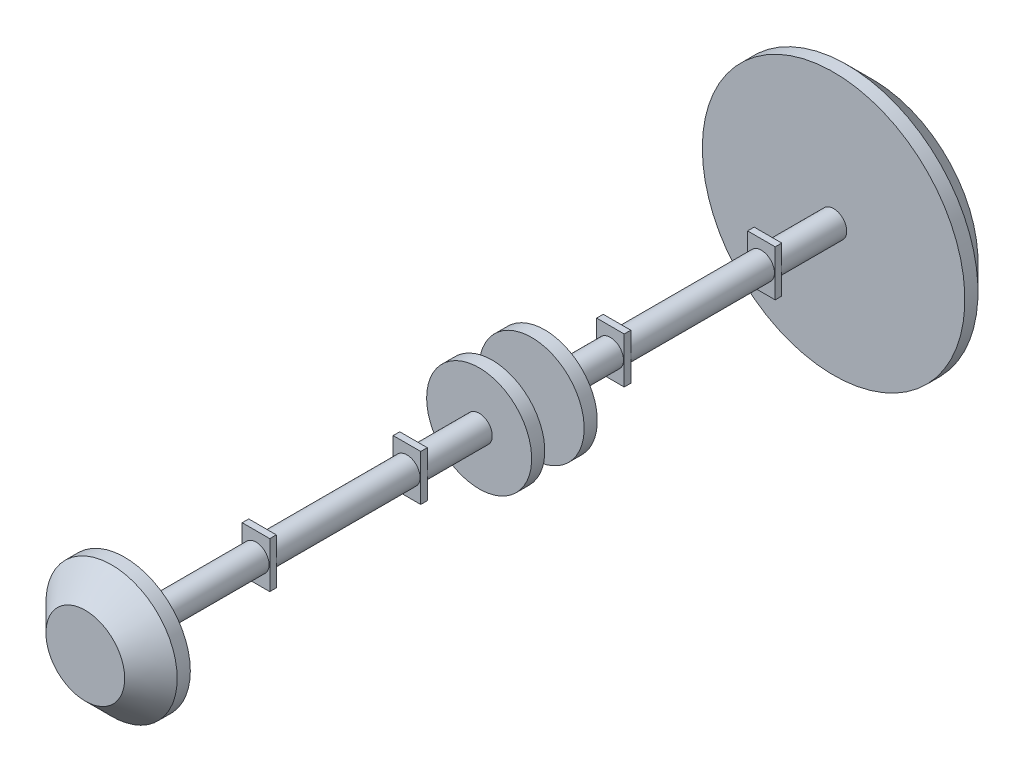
SolidWorks part; units mm, degrees
ref_plane "Plan de face" through (0, 0, 0) normal (0, 0, 1) x (1, 0, 0)
ref_plane "Plan de dessus" through (0, 0, 0) normal (0, 1, 0) x (1, 0, 0)
ref_plane "Plan de droite" through (0, 0, 0) normal (1, 0, 0) x (0, 0, -1)
sketch "Esquisse1" plane through (0, 0, 0) normal (0, 0, 1) x (1, 0, 0)
  circle A0 centre (0, 0) radius 10
  dimension "D1" = 20
extrude "Extrusion1" add sketch "Esquisse1" along normal blind 100
sketch "Esquisse2" plane through (0, 0, 0) normal (0, 0, -1) x (-1, 0, 0)
  line L1 (-10.5, 17.5) -> (10.5, 17.5)
  line L2 (-10.5, 17.5) -> (-10.5, -17.5)
  line L3 (-10.5, -17.5) -> (10.5, -17.5)
  line L4 (10.5, 17.5) -> (10.5, -17.5)
  dimension "D1" = 21
  dimension "D2" = 10.5
  dimension "D3" = 35
  dimension "D4" = 17.5
extrude "Extrusion2" add sketch "Esquisse2" along normal blind 5
sketch "Esquisse3" plane through (0, 0, -5) normal (0, 0, -1) x (-1, 0, 0)
  circle A0 centre (0, 0) radius 10 construction
  circle A1 centre (0, 0) radius 10
extrude "Extrusion3" add sketch "Esquisse3" along normal blind 110
sketch "Esquisse4" plane through (0, 0, -115) normal (0, 0, -1) x (-1, 0, 0)
  line L4 (-10.5, 17.5) -> (-10.5, -17.5)
  line L5 (-10.5, -17.5) -> (10.5, -17.5)
  line L6 (10.5, -17.5) -> (10.5, 17.5)
  line L7 (10.5, 17.5) -> (-10.5, 17.5)
  line L8 (-10.5, 17.5) -> (-10.5, -17.5)
  line L9 (-10.5, -17.5) -> (10.5, -17.5)
  line L10 (10.5, -17.5) -> (10.5, 17.5)
  line L11 (10.5, 17.5) -> (-10.5, 17.5)
  dimension "D1" = 0
extrude "Extrusion4" add sketch "Esquisse4" along normal blind 5
sketch "Esquisse5" plane through (0, 0, -120) normal (0, 0, -1) x (-1, 0, 0)
  circle A0 centre (0, 0) radius 10 construction
  circle A1 centre (0, 0) radius 10
extrude "Extrusion5" add sketch "Esquisse5" along normal blind 50
sketch "Esquisse7" plane through (0, 0, 100) normal (0, 0, 1) x (1, 0, 0)
  circle A0 centre (0, 0) radius 50
  dimension "D1" = 100
extrude "Extrusion7" add sketch "Esquisse7" along normal blind 30
sketch "Esquisse9" plane through (0, 0, 0) normal (0, 1, 0) x (1, 0, 0)
  line L0 (0, -130) -> (0, -160) construction
  line L1 (-50, -130) -> (50, -130) construction
  dimension "D1" = 30
chamfer "Chanfrein2" distance 20 angle 45 1 edges at (50, 0, 130)
sketch "Esquisse12" plane through (0, 0, -170) normal (0, 0, -1) x (-1, 0, 0)
  circle A0 centre (0, 0) radius 40
  dimension "D1" = 80
extrude "Extrusion10" add sketch "Esquisse12" along normal blind 10
sketch "Esquisse13" plane through (0, 0, -180) normal (0, 0, -1) x (-1, 0, 0)
  circle A0 centre (0, 0) radius 10 construction
  circle A1 centre (0, 0) radius 10
extrude "Extrusion11" add sketch "Esquisse13" along normal blind 30
sketch "Esquisse14" plane through (0, 0, -210) normal (0, 0, -1) x (-1, 0, 0)
  circle A0 centre (0, 0) radius 40 construction
  circle A1 centre (0, 0) radius 40
extrude "Extrusion12" add sketch "Esquisse14" along normal blind 10
sketch "Esquisse15" plane through (0, 0, -220) normal (0, 0, -1) x (-1, 0, 0)
  circle A0 centre (0, 0) radius 10 construction
  circle A1 centre (0, 0) radius 10
extrude "Extrusion13" add sketch "Esquisse15" along normal blind 50
sketch "Esquisse16" plane through (0, 0, 0) normal (0, 1, 0) x (1, 0, 0)
  line L1 (-40, 210) -> (40, 210)
  line L2 (-40, 210) -> (-40, 180)
  line L3 (-40, 180) -> (40, 180)
  line L4 (40, 210) -> (40, 180)
extrude "Enlèv. mat.-Extru.1" cut sketch "Esquisse16" against normal through all and the other way through all
sketch "Esquisse17" plane through (0, 0, -270) normal (0, 0, -1) x (-1, 0, 0)
  line L4 (10.5, 17.5) -> (-10.5, 17.5)
  line L5 (-10.5, 17.5) -> (-10.5, -17.5)
  line L6 (-10.5, -17.5) -> (10.5, -17.5)
  line L7 (10.5, -17.5) -> (10.5, 17.5)
  line L8 (10.5, 17.5) -> (-10.5, 17.5)
  line L9 (-10.5, 17.5) -> (-10.5, -17.5)
  line L10 (-10.5, -17.5) -> (10.5, -17.5)
  line L11 (10.5, -17.5) -> (10.5, 17.5)
  dimension "D1" = 0
extrude "Extrusion14" add sketch "Esquisse17" along normal blind 5
sketch "Esquisse18" plane through (0, 0, -275) normal (0, 0, -1) x (-1, 0, 0)
  circle A0 centre (0, 0) radius 10 construction
  circle A1 centre (0, 0) radius 10
extrude "Extrusion15" add sketch "Esquisse18" along normal blind 110
sketch "Esquisse19" plane through (0, 0, -385) normal (0, 0, -1) x (-1, 0, 0)
  line L4 (10.5, -17.5) -> (10.5, 17.5)
  line L5 (10.5, 17.5) -> (-10.5, 17.5)
  line L6 (-10.5, 17.5) -> (-10.5, -17.5)
  line L7 (-10.5, -17.5) -> (10.5, -17.5)
  line L8 (10.5, -17.5) -> (10.5, 17.5)
  line L9 (10.5, 17.5) -> (-10.5, 17.5)
  line L10 (-10.5, 17.5) -> (-10.5, -17.5)
  line L11 (-10.5, -17.5) -> (10.5, -17.5)
  dimension "D1" = 0
extrude "Extrusion16" add sketch "Esquisse19" along normal blind 5
sketch "Esquisse20" plane through (0, 0, -390) normal (0, 0, -1) x (-1, 0, 0)
  circle A0 centre (0, 0) radius 10 construction
  circle A1 centre (0, 0) radius 10
extrude "Extrusion17" add sketch "Esquisse20" along normal blind 50
sketch "Esquisse21" plane through (0, 0, -440) normal (0, 0, -1) x (-1, 0, 0)
  circle A0 centre (0, 0) radius 100
  dimension "D1" = 200
extrude "Extrusion18" add sketch "Esquisse21" along normal blind 30
chamfer "Chanfrein3" distance 20 angle 45 1 edges at (-100, 0, -470)
sketch "Esquisse22" plane through (0, 0, 0) normal (1, 0, 0) x (0, 0, -1)
  line L0 (470, 0) -> (500, 0) construction
  line L1 (470, -80) -> (470, 80) construction
  dimension "D1" = 30
